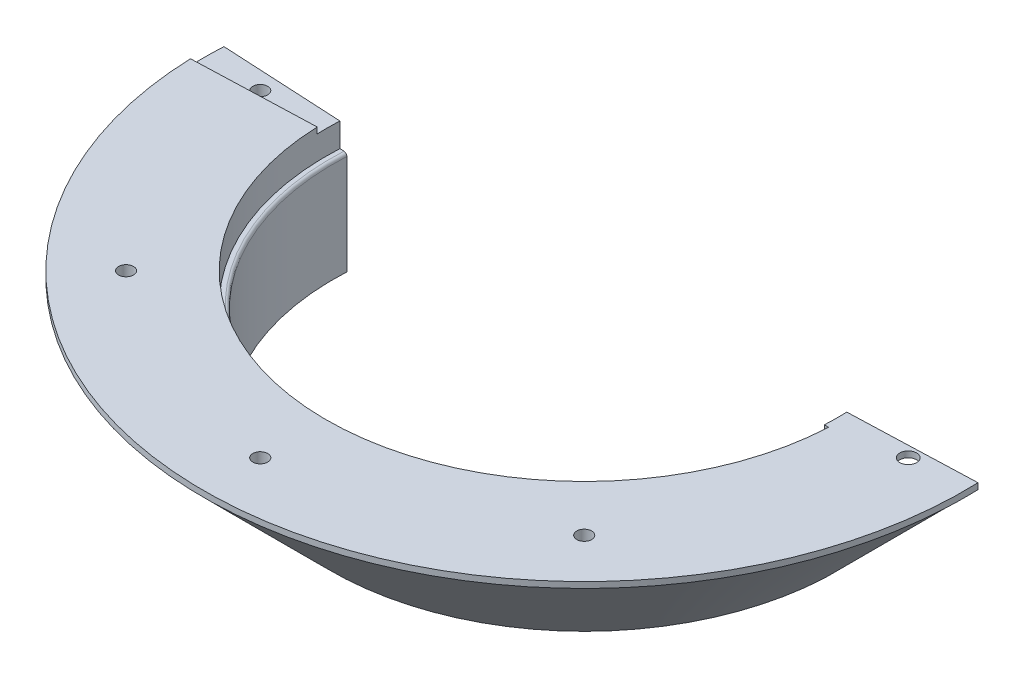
SolidWorks part; units mm, degrees
ref_plane "Front Plane" through (0, 0, 0) normal (0, 0, 1) x (1, 0, 0)
ref_plane "Top Plane" through (0, 0, 0) normal (0, 1, 0) x (1, 0, 0)
ref_plane "Right Plane" through (0, 0, 0) normal (1, 0, 0) x (0, 0, -1)
ref_axis "Axis1" through (0, 55.6325, 0) along (0, -1, 0)
ref_plane "Plane2" through (0, 0, 0) normal (0.0872, 0, 0.9962) x (0, -1, 0)
sketch "Sketch1" plane through (0, 0, 0) normal (0, 0, 1) x (1, 0, 0)
  line L0 (0, 0) -> (0, 51.4902) construction
  line L3 (-117.8838, 18.796) -> (-109.7915, 18.796)
  line L4 (-109.7915, 18.796) -> (-109.7915, 6.096)
  line L5 (-109.7915, 6.096) -> (-107.9627, 6.096)
  line L6 (-106.6927, 4.826) -> (-106.6927, -37.7063)
  line L7 (-106.4387, 6.096) -> (-106.4387, -806.704) construction
  line L8 (-161.925, 16.256) -> (-161.925, 18.796)
  line L9 (-117.8838, 18.796) -> (-161.925, 18.796)
  line L10 (-161.925, 16.256) -> (-107.9627, -37.7063)
  line L11 (-107.9627, -37.7063) -> (-106.6927, -37.7063)
  line L13 (-109.5375, 6.096) -> (109.5375, 6.096) construction
  line L15 (-109.5375, 19.05) -> (-109.5375, 6.35) construction
  arc A0 (-107.9627, 6.096) -> (-106.6927, 4.826) centre (-107.9627, 4.826) cw
  dimension "D4" = 1.27
  dimension "D1" = 1.27
  dimension "D2" = 0.254
  dimension "D3" = 2.54
  dimension "D5" = 0.254
  dimension "D6" = 0.254
  dimension "D7" = 45
  dimension "D8" = 323.85
revolve "Revolve1" add sketch "Sketch1" angle 360 about L0
hole_wizard "1/4-20 Tapped Hole1" positions "Sketch16" profile "Sketch15" tap size "1/4-20" standard "ANSI Inch"
sketch "Sketch16" plane through (0, 18.796, 0) normal (0, -1, 0) x (-1, 0, 0)
  circle A0 centre (-137.795, 0) radius 3.5719 construction
  point P0 (-137.795, 0)
sketch "Sketch15" plane through (137.795, 18.796, 0) normal (1, 0, 0) x (0, 0, 1)
  line L0 (0, 0) -> (0, 18.0438)
  line L1 (0, 18.0438) -> (2.5527, 16.51)
  line L2 (2.5527, 16.51) -> (2.5527, 12.7)
  line L3 (2.5527, 12.7) -> (3.175, 12.7)
  line L4 (3.175, 12.7) -> (3.175, 0)
  line L5 (3.175, 0) -> (0, 0)
  line L10 (0, 18.0438) -> (-2.5527, 16.51) construction
  line L11 (0, -6.35) -> (0, 107.95) construction
  dimension "Tap Drill Dia." = 5.1054
  dimension "Tap Drill Depth" = 16.51
  dimension "Thread Major Dia." = 6.35
  dimension "Thread Depth" = 12.7
  dimension "Drill Angle" = 118
pattern_circular "CirPattern1" count 8 over 360 about axis through (0, 0, 0) along (0, 1, 0) of "1/4-20 Tapped Hole1"
ref_plane "Plane3" through (0, 0, 0) normal (-0.7071, 0, -0.7071) x (-0.7071, 0, 0.7071)
ref_plane "Plane4" through (0, 0, 0) normal (0, 0, -1) x (-1, 0, 0)
ref_plane "Plane5" through (0, 0, 0) normal (-0.3827, 0, -0.9239) x (-0.9239, 0, 0.3827)
sketch "Sketch25" plane through (-153.4698, 0, 63.5693) normal (-0.3827, 0, -0.9239) x (-0.9239, 0, 0.3827)
  line L0 (-279.716, 18.796) -> (-279.716, 5.3848)
  line L1 (-4.1895, 18.796) -> (-328.0395, 18.796) construction
  line L2 (-279.716, 5.3848) -> (-276.6172, 2.286)
  line L3 (-276.6172, 2.286) -> (-276.6172, -29.7781)
  line L4 (-276.6172, -29.7781) -> (-325.1914, 18.796)
  line L6 (-325.1914, 18.796) -> (-279.716, 18.796)
  line L7 (-275.906, 6.096) -> (-278.1666, 3.8354) construction
  line L8 (-328.0395, 16.256) -> (-274.0772, -37.7063) construction
  point P8 (-272.8072, -37.7063)
  point P11 (-275.906, 18.796)
  dimension "D1" = 3.81
  dimension "D2" = 3.81
  dimension "D3" = 135
  dimension "D4" = 3.81
revolve "Cut-Revolve2" cut sketch "Sketch25" angle 35 mid plane about axis through (0, 55.6325, 0) along (0, -1, 0)
sketch "Sketch26" plane through (0, 0, 0) normal (-0.3827, 0, -0.9239) x (-0.9239, 0, 0.3827)
  line L0 (-110.5027, -29.7781) -> (-106.6927, -33.5881)
  line L1 (-106.6927, 4.826) -> (-106.6927, -37.7063) construction
  line L2 (-159.0768, 18.796) -> (-110.5027, -29.7781) construction
  line L3 (-106.6927, -33.5881) -> (-106.6927, -28.2)
  line L4 (-106.6927, 4.826) -> (-106.6927, -37.7063) construction
  line L5 (-106.6927, -28.2) -> (-110.5027, -24.39)
  line L6 (-110.5027, 2.286) -> (-110.5027, -29.7781) construction
  line L7 (-110.5027, -24.39) -> (-110.5027, -29.7781)
  dimension "D1" = 3.81
revolve "Cut-Revolve3" cut sketch "Sketch26" angle 15 mid plane about axis through (0, 55.6325, 0) along (0, -1, 0)
sketch "Sketch31" plane through (0, 0, 0) normal (-0.3827, 0, -0.9239) x (-0.9239, 0, 0.3827)
  line L0 (-159.0768, 18.796) -> (-149.225, 8.9442)
  line L3 (-159.0768, 18.796) -> (-106.6927, -33.5881) construction
  line L4 (-149.225, 8.9442) -> (-149.225, 31.496)
  line L5 (-155.575, 31.496) -> (-155.575, 18.796)
  line L6 (-159.0768, 18.796) -> (-113.6015, 18.796) construction
  line L7 (-155.575, 18.796) -> (-159.0768, 18.796)
  line L8 (-149.225, 31.496) -> (-155.575, 31.496)
  line L9 (0, 0) -> (0, 58.613) construction
  line L10 (-110.5027, -29.7781) -> (-159.0768, 18.796) construction
  dimension "D1" = 311.15
  dimension "D2" = 6.35
  dimension "D3" = 12.7
sketch "Sketch21" plane through (0, 18.796, 0) normal (0, -1, 0) x (1, 0, 0)
  line L0 (-161.7031, -8.4745) -> (161.925, 8.4861)
  line L1 (0, 0) -> (100.5903, 0) construction
  line L3 (-161.7031, -8.4745) -> (-161.7031, -168.577)
  line L4 (-161.7031, -168.577) -> (161.925, -168.577)
  line L5 (161.925, -168.577) -> (161.925, 8.4861)
  circle A0 centre (0, 0) radius 161.925 construction
  circle A1 centre (0, 0) radius 161.925 construction
  dimension "D1" = 3
extrude "Cut-Extrude1" cut sketch "Sketch21" along normal through all
sketch "Sketch22" plane through (0, 18.796, 0) normal (0, 1, 0) x (1, 0, 0)
  line L0 (-161.8264, -5.6511) -> (-107.8969, -3.7678)
  line L1 (-161.7031, 8.4745) -> (-107.8147, 5.6503)
  line L2 (-107.8969, -3.7678) -> (0, 0) construction
  arc A0 (-107.8147, 5.6503) -> (-107.8969, -3.7678) centre (0, 0) ccw
  arc A1 (-161.7031, 8.4745) -> (-161.8264, -5.6511) centre (0, 0) ccw
  dimension "D1" = 5
extrude "Cut-Extrude2" cut sketch "Sketch22" against normal up to vertex (3.175 mm away)
sketch "Sketch23" plane through (0, 18.796, 0) normal (0, 1, 0) x (1, 0, 0)
  line L0 (107.8969, 3.7678) -> (161.8264, 5.6511)
  line L1 (107.8147, -5.6503) -> (161.7031, -8.4745)
  line L2 (0, 0) -> (107.8969, 3.7678) construction
  arc A0 (107.8147, -5.6503) -> (107.8969, 3.7678) centre (0, 0) ccw
  arc A1 (161.7031, -8.4745) -> (161.8264, 5.6511) centre (0, 0) ccw
  dimension "D1" = 5
extrude "Boss-Extrude6" add sketch "Sketch23" against normal up to surface (2.54 mm away)
hole_wizard "9/32 (0.28125) Diameter Hole1" positions "Sketch28" profile "Sketch27" hole size "9/32" standard "ANSI Inch"
sketch "Sketch28" plane through (0, 18.796, 0) normal (0, 1, 0) x (1, 0, 0)
  line L0 (-137.795, 0) -> (137.795, 0) construction
  point P0 (137.795, 0)
sketch "Sketch27" plane through (137.795, 18.796, 0) normal (1, 0, 0) x (0, 0, 1)
  line L0 (0, 0) -> (0, 56.5023)
  line L1 (0, 56.5023) -> (3.5719, 56.5023)
  line L2 (3.5719, 56.5023) -> (3.5719, 0)
  line L5 (3.5719, 0) -> (0, 0)
  line L11 (0, -6.35) -> (0, 107.95) construction
  dimension "Thru Hole Dia." = 7.1437
  dimension "Thru Hole Depth" = 56.5023
